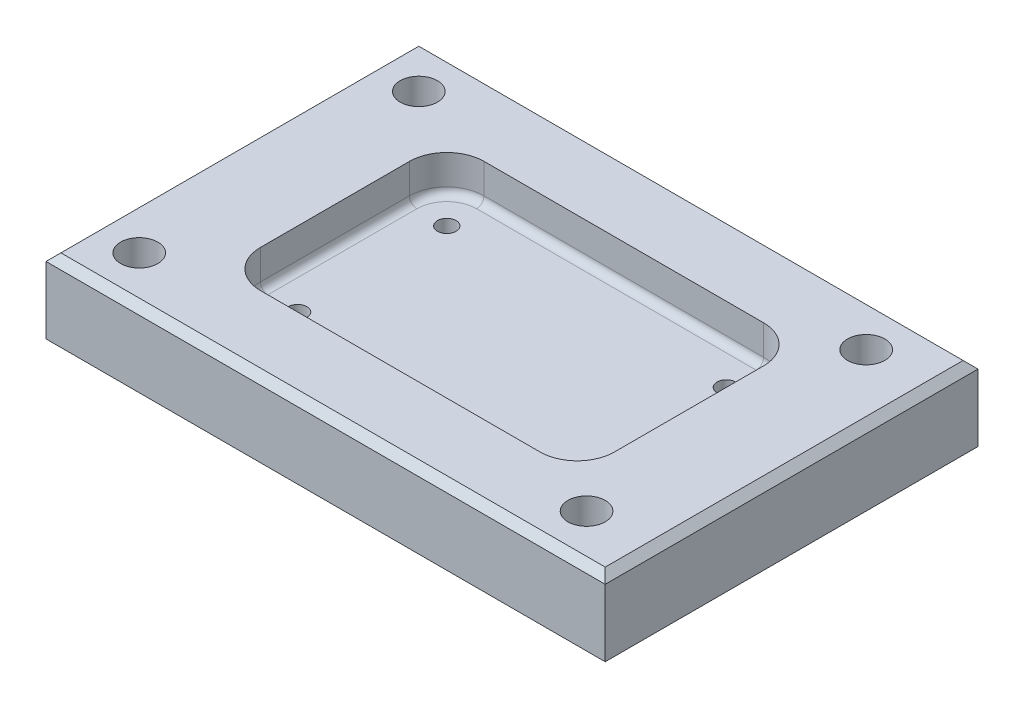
SolidWorks part; units mm, degrees
ref_plane "Front" through (0, 0, 0) normal (0, 0, 1) x (1, 0, 0)
ref_plane "Top" through (0, 0, 0) normal (0, 1, 0) x (1, 0, 0)
ref_plane "Right" through (0, 0, 0) normal (1, 0, 0) x (0, 0, -1)
sketch "Sketch1" plane through (0, 0, 0) normal (0, 1, 0) x (1, 0, 0)
  line L0 (75, -50) -> (-75, 50) construction
  line L1 (-75, 50) -> (75, 50)
  line L2 (-75, 50) -> (-75, -50)
  line L3 (-75, -50) -> (75, -50)
  line L4 (75, 50) -> (75, -50)
  dimension "D1" = 150
  dimension "D2" = 100
extrude "Boss-Extrude1" add sketch "Sketch1" along normal blind 20
sketch "Sketch2" plane through (0, 20, 0) normal (0, 1, 0) x (-1, 0, 0)
  line L0 (47.5, -30) -> (-47.5, 30) construction
  line L1 (-37.5, 30) -> (37.5, 30)
  line L2 (-47.5, 20) -> (-47.5, -20)
  line L3 (-37.5, -30) -> (37.5, -30)
  line L4 (47.5, 20) -> (47.5, -20)
  arc A0 (37.5, 30) -> (47.5, 20) centre (37.5, 20) cw
  arc A1 (37.5, -30) -> (47.5, -20) centre (37.5, -20) ccw
  arc A2 (-47.5, -20) -> (-37.5, -30) centre (-37.5, -20) ccw
  arc A3 (-37.5, 30) -> (-47.5, 20) centre (-37.5, 20) ccw
  point P6 (47.5, 30)
  point P12 (-47.5, -30)
  dimension "D3" = 10
  dimension "D1" = 95
  dimension "D2" = 60
extrude "Pocket" cut sketch "Sketch2" against normal blind 10
fillet "Fillet1" radius 2 8 edges at (-44.5711, 10, -27.0711) (0, 10, -30) (44.5711, 10, -27.0711) (47.5, 10, 0) (44.5711, 10, 27.0711) (0, 10, 30) (-44.5711, 10, 27.0711) (-47.5, 10, 0)
sketch "Sketch3" plane through (0, 10, 0) normal (0, 1, 0) x (-1, 0, 0)
  line L0 (-47.5, 20) -> (-47.5, -20) construction
  line L1 (37.5, 30) -> (-37.5, 30) construction
  circle A0 centre (-37.5, 20) radius 2.5
  dimension "D1" = 5
  dimension "D2" = 10
  dimension "D3" = 10
extrude "Dia 5 Hole" cut sketch "Sketch3" against normal through all
pattern_linear "Dia 5X4 Hole" count 2 spacing 75 along (-1, 0, 0) count 2 spacing 40 along (0, 0, -1) of "Dia 5 Hole"
sketch "Sketch4" plane through (0, 20, 0) normal (0, 1, 0) x (-1, 0, 0)
  line L0 (75, 50) -> (-75, 50) construction
  line L1 (75, -50) -> (75, 50) construction
  circle A0 centre (62.5, 37.5) radius 5
  dimension "D1" = 10
  dimension "D2" = 12.5
  dimension "D3" = 12.5
extrude "Dia 10 Hole" cut sketch "Sketch4" against normal through all
pattern_linear "Dia 10X4 Hole" count 2 spacing 75 along (0, 0, -1) count 2 spacing 120 along (1, 0, 0) of "Dia 10 Hole"
chamfer "Chamfer1" distance 2 angle 45 4 edges at (-75, 20, 0) (0, 20, -50) (75, 20, 0) (0, 20, 50)
